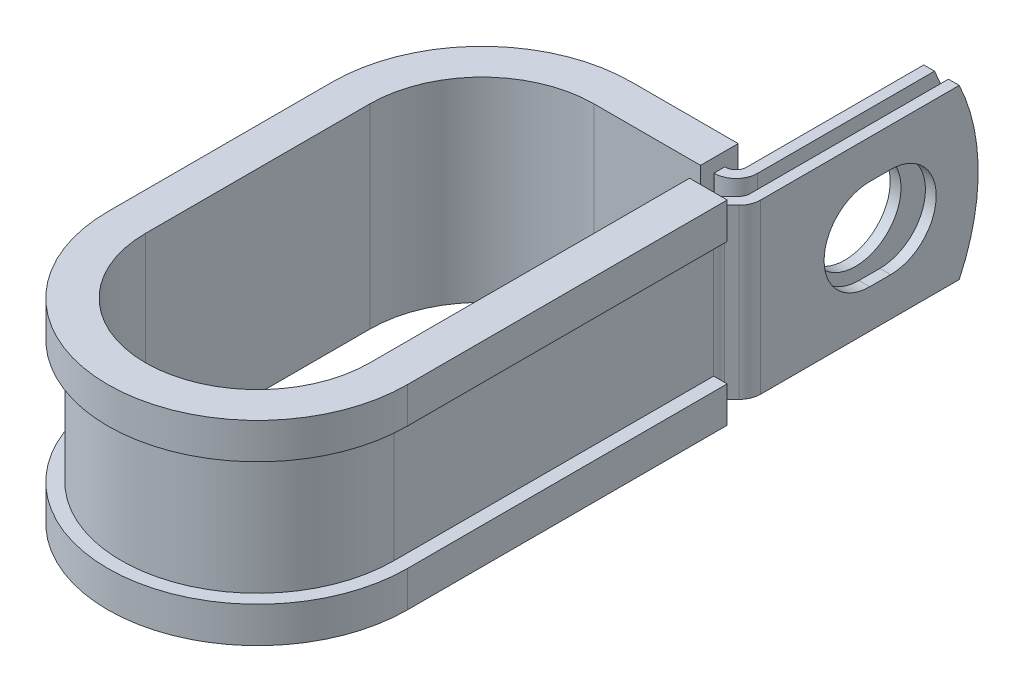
SolidWorks part; units mm, degrees
ref_plane "Front Plane" through (0, 0, 0) normal (0, 0, 1) x (1, 0, 0)
ref_plane "Top Plane" through (0, 0, 0) normal (0, 1, 0) x (1, 0, 0)
ref_plane "Right Plane" through (0, 0, 0) normal (1, 0, 0) x (0, 0, -1)
sketch "Sketch1" plane through (0, 0, 0) normal (0, 1, 0) x (1, 0, 0)
  line L0 (0, 14.224) -> (12.1083, 14.224)
  line L1 (14.224, 0) -> (14.224, 10.8115)
  line L2 (14.5467, 38.862) -> (14.5467, 16.6624)
  line L3 (14.9382, 12.5357) -> (15.7644, 13.3619)
  line L4 (-14.224, 0) -> (-14.224, -25.4)
  line L5 (16.1215, 14.224) -> (16.1215, 38.862)
  line L6 (14.224, 0) -> (14.224, -25.4)
  arc A0 (0, 14.224) -> (-14.224, 0) centre (0, 0) ccw
  arc A1 (14.9382, 12.5357) -> (14.224, 10.8115) centre (16.6624, 10.8115) ccw
  arc A2 (15.7644, 13.3619) -> (16.1215, 14.224) centre (14.9023, 14.224) ccw
  arc A3 (12.1083, 14.224) -> (14.5467, 16.6624) centre (12.1083, 16.6624) ccw
  arc A4 (-14.224, -25.4) -> (14.224, -25.4) centre (0, -25.4) ccw
extrude "Extrude-Thin1" add sketch "Sketch1" along normal mid plane 19.05 thin
sketch "Sketch2" plane through (13.3275, 0, 0) normal (-1, 0, 0) x (0, 0, 1)
  line L0 (-38.862, 9.525) -> (-38.862, -9.525) construction
  line L1 (0, 9.525) -> (0, -9.525) construction
  circle A0 centre (-27.7622, 0) radius 5.1562
  point P2 (-38.862, 0)
extrude "Cut-Extrude1" cut sketch "Sketch2" against normal up to surface (1.2192 mm away)
sketch "Sketch3" plane through (17.3407, 0, 0) normal (1, 0, 0) x (0, 0, -1)
  line L0 (26.5684, 0) -> (28.956, 0) construction
  line L1 (26.5684, 5.1562) -> (28.956, 5.1562)
  line L2 (26.5684, -5.1562) -> (28.956, -5.1562)
  line L3 (38.862, 9.525) -> (38.862, -9.525) construction
  arc A0 (26.5684, 5.1562) -> (26.5684, -5.1562) centre (26.5684, 0) ccw
  arc A1 (28.956, -5.1562) -> (28.956, 5.1562) centre (28.956, 0) ccw
  point P3 (27.7622, 0)
  point P8 (38.862, 0)
  point P11 (21.4122, 0)
  point P12 (34.1122, 0)
extrude "Cut-Extrude2" cut sketch "Sketch3" against normal up to surface (1.2192 mm away)
sketch "Sketch4" plane through (13.3275, 0, 0) normal (-1, 0, 0) x (0, 0, 1)
  line L0 (-38.862, 9.525) -> (-38.862, -9.525)
  line L1 (-38.862, 9.525) -> (-36.7175, 9.525)
  line L2 (-38.862, 9.525) -> (-16.6624, 9.525) construction
  line L3 (-38.862, -9.525) -> (-36.7175, -9.525)
  line L4 (-38.862, -9.525) -> (-16.6624, -9.525) construction
  arc A0 (-36.7175, 9.525) -> (-36.7175, -9.525) centre (-16.637, 0) ccw
extrude "Cut-Extrude3" cut sketch "Sketch4" against normal through all contours A0 M4 M5 | A0 L0 M2
ref_plane "Plane1" through (0, 0, -10.8115) normal (0, 0, -1) x (-1, 0, 0)
ref_plane "Plane2" through (12.0575, 0, 0) normal (-1, 0, 0) x (0, 0, 1)
sketch "Sketch5" plane through (0, 0, -10.8115) normal (0, 0, -1) x (-1, 0, 0)
  line L0 (-15.4432, 9.525) -> (-14.224, 9.525)
  line L1 (-15.4432, 9.525) -> (-15.4432, -9.525) construction
  line L3 (-14.224, 9.525) -> (-14.224, -9.525)
  line L4 (-14.224, -9.525) -> (-15.4432, -9.525)
  line L5 (-15.4432, -9.525) -> (-15.4432, -6.985)
  line L6 (-15.4432, 9.525) -> (-15.4432, 6.985)
  line L7 (-16.9672, 11.049) -> (-16.9672, 6.985)
  line L8 (-16.9672, 11.049) -> (-12.7, 11.049)
  line L9 (-12.7, 11.049) -> (-12.7, -11.049)
  line L10 (-12.7, -11.049) -> (-16.9672, -11.049)
  line L11 (-16.9672, -11.049) -> (-16.9672, -6.985)
  line L12 (-16.9672, 6.985) -> (-15.4432, 6.985)
  line L13 (-15.4432, -6.985) -> (-16.9672, -6.985)
sketch "Sketch6" plane through (0, 9.525, 0) normal (0, 1, 0) x (1, 0, 0)
  line L0 (12.7, 0) -> (12.7, 10.8115)
  line L1 (12.7, 10.8115) -> (16.9672, 10.8115) construction
  line L2 (12.0575, 6.9878) -> (12.0575, -6.9878) construction
  line L3 (12.7, -25.4) -> (12.7, 0)
  line L4 (-12.7, -25.4) -> (-12.7, 0)
  line L5 (0, 12.7) -> (12.0575, 12.7)
  arc A0 (0, 12.7) -> (-12.7, 0) centre (0, 0) ccw
  arc A1 (-12.7, -25.4) -> (12.7, -25.4) centre (0, -25.4) ccw
sweep "Sweep1" add profiles "Sketch5" path "Sketch6"
equation "\"D4@Sketch5\" = \"D1@Extrude-Thin1\""
equation "\"D5@Sketch5\" = \"D5@Extrude-Thin1\""
equation "\"D1@Sketch3\" = \"D2@Sketch2\""
equation "\"D7@Sketch1\" = \"D3@Sketch2\" + \"D1@Sketch3\""
equation "\"D1@Sketch1\" = \"D1@Sketch6\" + 2 * \"D3@Sketch5\""
equation "\"D1@Sketch4\" = ( \"D1@Extrude-Thin1\" + .125 ) * 2"
equation "\"D9@Sketch1\"= \"D5@Extrude-Thin1\""
equation "\"D8@Sketch1\"= 2 * \"D5@Extrude-Thin1\""
equation "\"D2@Sketch1\" = 2 * \"D5@Extrude-Thin1\""
equation "\"D2@Sketch3\" = \"D1@Sketch2\""
equation "\"D6@Sketch1\" = \"D1@Sketch1\""
equation "\"D3@Sketch1\" = \"D1@Sketch6\""
